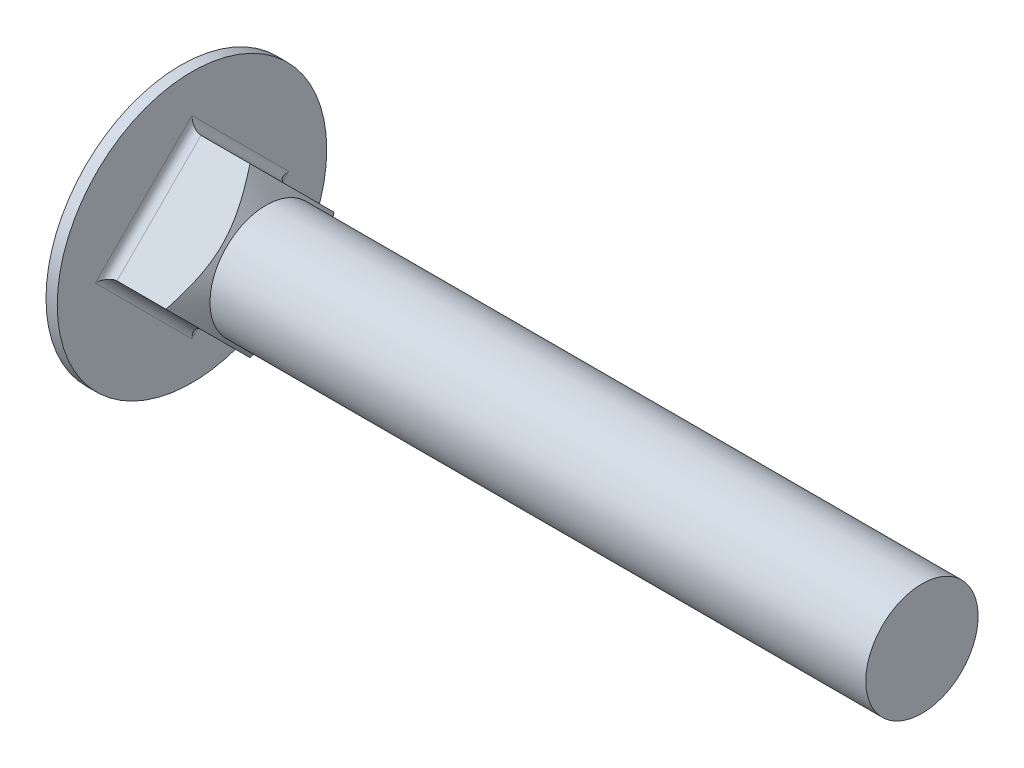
SolidWorks part; units mm, degrees
ref_plane "Front" through (0, 0, 0) normal (0, 0, 1) x (1, 0, 0)
ref_plane "Top" through (0, 0, 0) normal (0, 1, 0) x (1, 0, 0)
ref_plane "Right" through (0, 0, 0) normal (1, 0, 0) x (0, 0, -1)
sketch "Sketch1" plane through (0, 0, 0) normal (0, 0, 1) x (1, 0, 0)
  line L0 (-9.8282, 0) -> (16.3483, 0) construction
  line L1 (4, 12) -> (5, 12)
  line L2 (0, 0) -> (5, 0)
  line L3 (5, 12) -> (5, 0)
  arc A0 (4, 12) -> (0, 0) centre (20, 0) ccw
  dimension "k" = 5
  dimension "dk" = 24
  dimension "H" = 1
revolve "BaseHead" add sketch "Sketch1" angle 360 about L0
sketch "Sketch2" plane through (5, 0, 0) normal (1, 0, 0) x (0, 0, -1)
  line L1 (-7.4812, 0) -> (0, -7.4812)
  line L2 (0, -7.4812) -> (7.4812, 0)
  line L3 (7.4812, 0) -> (0, 7.4812)
  line L4 (0, 7.4812) -> (-7.4812, 0)
  circle A0 centre (0, 0) radius 5.29 construction
  dimension "Ss" = 10.58
extrude "Neck" add sketch "Sketch2" along normal blind 6.6
sketch "Sketch3" plane through (0, 0, 0) normal (0, 0, 1) x (1, 0, 0)
  line L0 (5, 0) -> (14.6279, 0) construction
  line L1 (11.6, 7.4812) -> (10.1675, 7.4812)
  line L3 (10.1675, 7.4812) -> (11.6, 5)
  line L5 (11.6, 5) -> (11.6, 7.4812)
  dimension "D1" = 30
revolve "Cut-Revolve1" cut sketch "Sketch3" angle 360 about L0
fillet "HeadFillet" radius 0.8 4 edges at (5, 3.7406, -3.7406) (5, -3.7406, -3.7406) (5, -3.7406, 3.7406) (5, 3.7406, 3.7406)
sketch "Sketch4" plane through (0, 0, 0) normal (0, 1, 0) x (1, 0, 0)
  line L0 (-12.2854, 0) -> (59.7905, 0) construction
  line L1 (70, 5) -> (44, 5)
  line L3 (44, 5) -> (11.6, 5)
  line L4 (5, -12) -> (5, 12) construction
  line L5 (70, 5) -> (70, 0)
  line L6 (70, 0) -> (11.6, 0)
  line L7 (11.6, 0) -> (11.6, 5)
  line L10 (11.6, -5) -> (11.6, 5) construction
  dimension "l" = 65
revolve "Revolve1" add sketch "Sketch4" angle 360 about L0
sketch "Sketch5" plane through (0, 0, 0) normal (0, 0, 1) x (1, 0, 0)
  line L0 (69.594, 5.2) -> (70.406, 5.2)
  line L1 (70.406, 5.2) -> (70.406, 5)
  line L2 (70.406, 5) -> (70, 4.2968)
  line L3 (69.594, 5) -> (70, 4.2968)
  line L4 (69.594, 5.2) -> (69.594, 5)
  line L5 (-65.6461, 0) -> (65.6461, 0) construction
  line L6 (69.594, 5) -> (70.406, 5) construction
  line L7 (70, 5) -> (70, 4.2968) construction
  line L8 (70, -5) -> (70, 5) construction
  line L10 (70, 5) -> (11.6, 5) construction
  point P5 (70, 5.2)
  dimension "D1" = 0.2
  dimension "D2" = 0.812
revolve "Cut-Revolve10" [suppressed] cut sketch "Sketch5" angle 360 about L5
pattern_linear "LPattern10" [suppressed] count 27 spacing 0.9744 along (1, 0, 0)
equation "\"D2@Sketch5\" =  ( \"d@Sketch4\" - \"dn@ThreadCosmetic1\" )  / 2"
equation "\"D3@LPattern10\" = \"D2@Sketch5\" * 1.2"
equation "\"D1@LPattern10\" = \"b@Sketch4\" / \"D3@LPattern10\" "
equation "\"H@Sketch1\" = \"k@Sketch1\" / 5"
